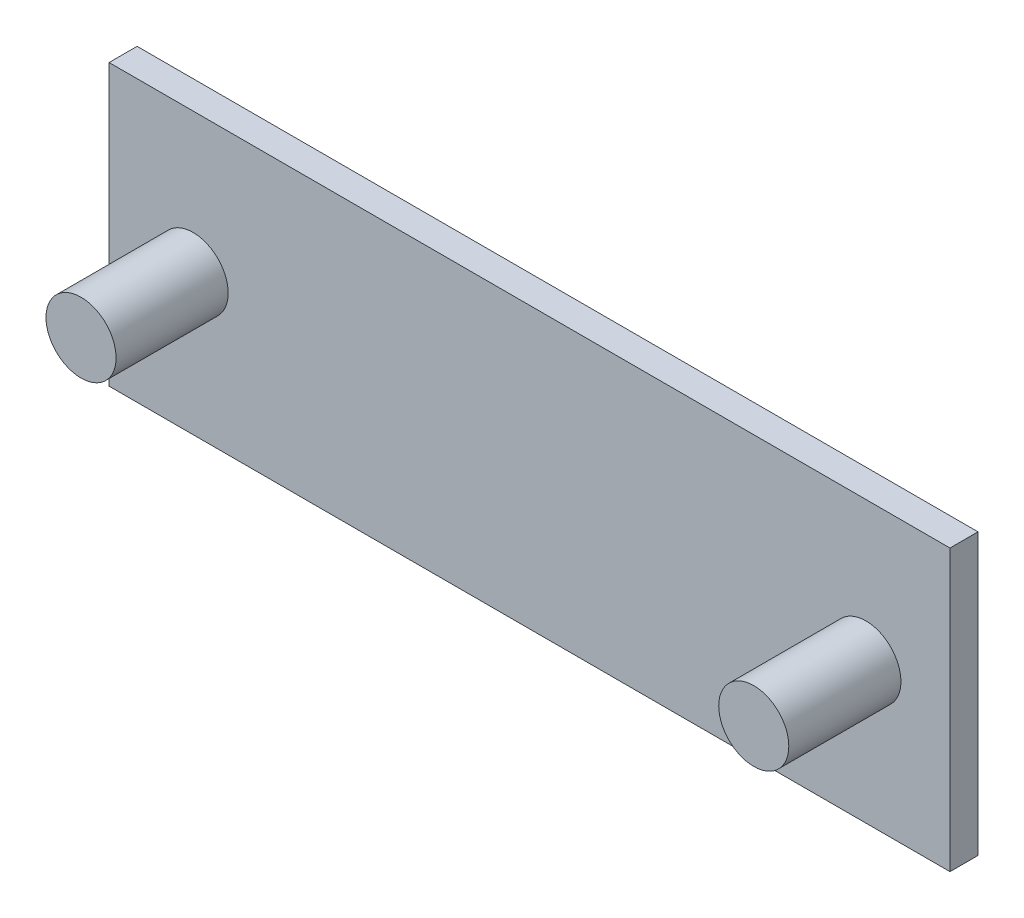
SolidWorks part; units mm, degrees
ref_plane "Ebene vorne" through (0, 0, 0) normal (0, 0, 1) x (1, 0, 0)
ref_plane "Ebene oben" through (0, 0, 0) normal (0, 1, 0) x (1, 0, 0)
ref_plane "Ebene rechts" through (0, 0, 0) normal (1, 0, 0) x (0, 0, -1)
sketch "Skizze1" plane through (0, 0, 0) normal (0, 0, 1) x (1, 0, 0)
  line L0 (0, 0) -> (300, 0)
  line L1 (300, 0) -> (300, 100)
  line L2 (300, 100) -> (0, 100)
  line L3 (0, 100) -> (0, 0)
extrude "Linear austragen1" add sketch "Skizze1" along normal blind 10
sketch "Skizze2" plane through (0, 0, 10) normal (0, 0, 1) x (1, 0, 0)
  line L0 (0, 0) -> (300, 0) construction
  line L1 (0, 100) -> (0, 0) construction
  circle A0 centre (30, 50) radius 12.5
  dimension "D1" = 50
  dimension "D2" = 30
extrude "Linear austragen2" add sketch "Skizze2" along normal blind 40
sketch "Skizze3" plane through (0, 0, 10) normal (0, 0, 1) x (1, 0, 0)
  circle A0 centre (270, 50) radius 12.5
extrude "Linear austragen3" add sketch "Skizze3" along normal blind 40
